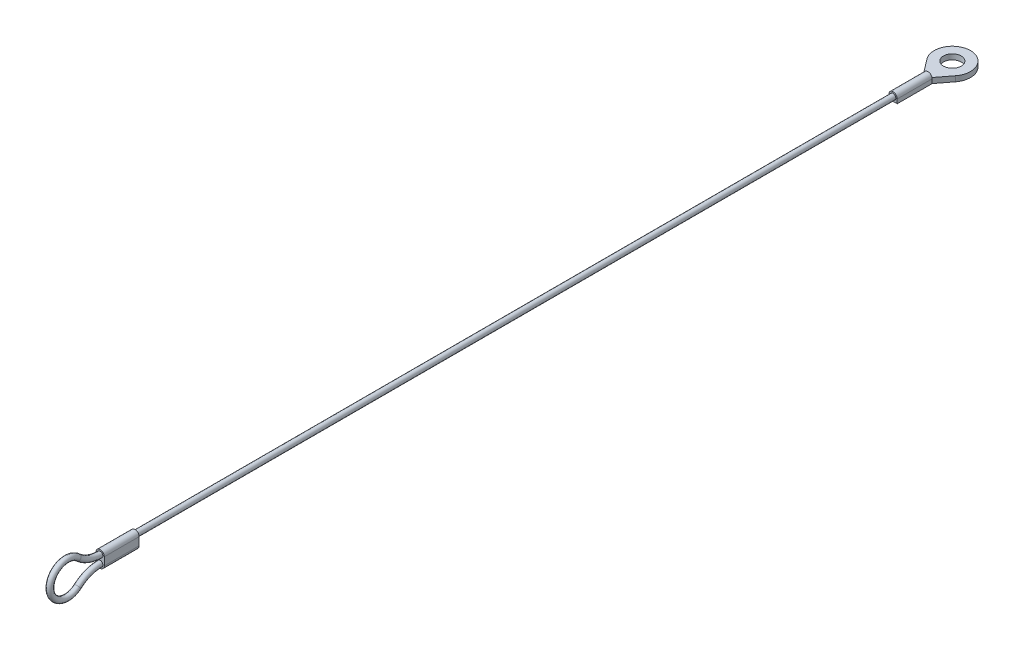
SolidWorks part; units mm, degrees
ref_plane "Front Plane" through (0, 0, 0) normal (0, 0, 1) x (1, 0, 0)
ref_plane "Top Plane" through (0, 0, 0) normal (0, 1, 0) x (1, 0, 0)
ref_plane "Right Plane" through (0, 0, 0) normal (1, 0, 0) x (0, 0, -1)
sketch "Sketch1" plane through (0, 0, 0) normal (1, 0, 0) x (0, 0, -1)
  line L2 (-227.4, 0) -> (0, 0)
  arc A0 (-227.4, 0) -> (-233.8, 2.4446) centre (-227.4, 9.6) cw
  arc A1 (-233.8, 2.4446) -> (-233.8, -4.7108) centre (-237, -1.1331) ccw
  arc A2 (-233.8, -4.7108) -> (-227.4, -2.2663) centre (-227.4, -11.8663) cw
  dimension "D1" = 4.8
  dimension "D4" = 9.6
  dimension "D2" = 237
  dimension "D3" = 9.6
sketch "Sketch2" plane through (0, 0, 0) normal (0, 0, 1) x (1, 0, 0)
  circle A0 centre (0, 0) radius 0.795
  dimension "D1" = 1.59
sweep "Sweep1" add profiles "Sketch2" path "Sketch1"
sketch "Sketch3" plane through (0, 0, 227.4) normal (0, 0, -1) x (-1, 0, 0)
  line L0 (0, 0) -> (0, -2.2663) construction
  line L1 (1.195, 0) -> (1.195, -2.2663)
  line L2 (-1.195, 0) -> (-1.195, -2.2663)
  line L3 (-0.795, -2.2663) -> (0.795, -2.2663) construction
  arc A0 (1.195, 0) -> (-1.195, 0) centre (0, 0) ccw
  arc A1 (-1.195, -2.2663) -> (1.195, -2.2663) centre (0, -2.2663) ccw
  point P3 (0, -1.1331)
  dimension "D1" = 2.39
extrude "Boss-Extrude1" add sketch "Sketch3" along normal blind 10
sketch "Sketch4" plane through (0, 0, 0) normal (0, 0, -1) x (-1, 0, 0)
  line L0 (-1.195, 0) -> (-1.195, -1.195)
  line L1 (-1.195, -1.195) -> (0, -1.195)
  line L2 (0, -1.195) -> (1.195, -1.195)
  line L3 (1.195, -1.195) -> (1.195, 0)
  arc A0 (1.195, 0) -> (-1.195, 0) centre (0, 0) ccw
  dimension "D1" = 2.39
extrude "Boss-Extrude2" add sketch "Sketch4" along normal blind 10
sketch "Sketch5" plane through (0, -1.195, 0) normal (0, -1, 0) x (1, 0, 0)
  line L0 (-1.195, -10) -> (1.195, -10)
  line L1 (1.195, -10) -> (4.1323, -13.8352)
  line L2 (-4.1323, -13.8352) -> (-1.195, -10)
  arc A0 (4.1323, -13.8352) -> (-4.1323, -13.8352) centre (0, -17) cw
  circle A1 centre (0, -17) radius 2.54
  point P8 (-5.205, -17)
  point P9 (5.205, -17)
  dimension "D1" = 5.08
  dimension "D2" = 10.41
  dimension "D3" = 17
extrude "Boss-Extrude3" add sketch "Sketch5" against normal blind 1.52
